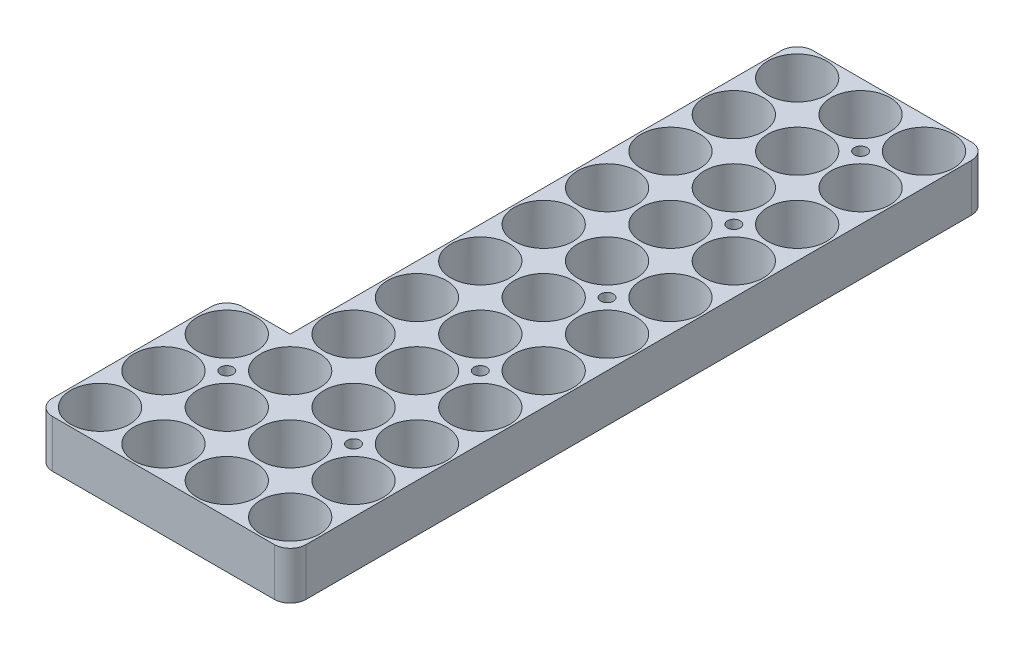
SolidWorks part; units mm, degrees
ref_plane "Plan de face" through (0, 0, 0) normal (0, 0, 1) x (1, 0, 0)
ref_plane "Plan de dessus" through (0, 0, 0) normal (0, 1, 0) x (1, 0, 0)
ref_plane "Plan de droite" through (0, 0, 0) normal (1, 0, 0) x (0, 0, -1)
sketch "Esquisse1" plane through (0, 0, 0) normal (0, 1, 0) x (1, 0, 0)
  line L0 (-50, 0) -> (50, 0) construction
  line L1 (50, 0) -> (50, 60) construction
  line L2 (50, 60) -> (30, 60) construction
  line L3 (30, 60) -> (30, 220)
  line L4 (30, 220) -> (-30, 220)
  line L5 (-30, 220) -> (-30, 60)
  line L6 (-30, 60) -> (-50, 60)
  line L7 (-50, 60) -> (-50, 0)
  line L8 (30, 60) -> (30, 0)
  line L9 (30, 0) -> (-50, 0)
  dimension "D1" = 20
  dimension "D2" = 60
  dimension "D3" = 220
  dimension "D4" = 60
extrude "Boss.-Extru.1" add sketch "Esquisse1" along normal blind 15
sketch "Esquisse2" plane through (0, 15, 0) normal (0, 1, 0) x (1, 0, 0)
  line L0 (-50, 60) -> (-50, 0) construction
  line L2 (-50, 0) -> (30, 0) construction
  circle A0 centre (-40, 10) radius 9.3
  dimension "D3" = 18.6
  dimension "D1" = 10
  dimension "D2" = 10
extrude "Enlèv. mat.-Extru.1" cut sketch "Esquisse2" against normal offset from surface (13.5 mm away) 1.5
pattern_linear "Répétition linéaire1" count 11 spacing 20 along (0, 0, -1) count 6 spacing 20 along (1, 0, 0) of "Enlèv. mat.-Extru.1"
sketch "Esquisse3" plane through (0, 15, 0) normal (0, 1, 0) x (1, 0, 0)
  line L2 (-40, 50) -> (-20, 30) construction
  circle A0 centre (-30, 40) radius 2
  circle A1 centre (-40, 50) radius 9.3 construction
  circle A3 centre (-20, 30) radius 9.3 construction
  dimension "D1" = 4
extrude "Enlèv. mat.-Extru.2" cut sketch "Esquisse3" against normal through all
pattern_linear "Répétition linéaire2" count 2 spacing 40 along (1, 0, 0) of "Enlèv. mat.-Extru.2"
pattern_linear "Répétition linéaire3" count 5 spacing 40 along (0, 0, -1) of "Répétition linéaire2"
sketch "Esquisse6" plane through (0, 0, 0) normal (0, -1, 0) x (1, 0, 0)
  line L0 (-29, -5) -> (-29, -15)
  line L1 (-29, -5) -> (29, -5)
  line L2 (-29, -15) -> (29, -15)
  line L3 (29, -5) -> (29, -15)
  line L4 (30, 0) -> (30, -220) construction
  line L5 (0, 0) -> (0, -5) construction
  line L6 (-50, 0) -> (30, 0) construction
  point P9 (-29, -10)
  dimension "D1" = 10
  dimension "D2" = 1
  dimension "D3" = 10
extrude "Enlèv. mat.-Extru.5" cut sketch "Esquisse6" against normal up to surface (1.5 mm away) contours L1 L3 L2 L0
pattern_linear "Répétition linéaire6" count 11 spacing 20 along (0, 0, -1) of "Enlèv. mat.-Extru.5"
sketch "Esquisse7" plane through (0, 0, 0) normal (0, -1, 0) x (1, 0, 0)
  line L0 (-45, -1) -> (-45, -59)
  line L1 (-45, -1) -> (-35, -1)
  line L2 (-45, -59) -> (-35, -59)
  line L3 (-35, -1) -> (-35, -59)
  line L4 (-29, -15) -> (29, -15) construction
  line L5 (-29, -5) -> (-29, -15) construction
  line L6 (-50, -60) -> (-50, 0) construction
  line L7 (-30, -60) -> (-50, -60) construction
  point P8 (-40, -59)
  dimension "D1" = 10
  dimension "D2" = 1
extrude "Enlèv. mat.-Extru.6" cut sketch "Esquisse7" against normal up to surface (1.5 mm away)
sketch "Esquisse8" plane through (0, 0, 0) normal (0, -1, 0) x (1, 0, 0)
  line L0 (-27.8416, -195) -> (-25, -197.8416)
  line L1 (-25, -197.8416) -> (-25, -202.1584)
  line L2 (-25, -202.1584) -> (-27.8416, -205)
  line L3 (-27.8416, -205) -> (-12.1584, -205)
  line L4 (-12.1584, -205) -> (-15, -202.1584)
  line L5 (-15, -202.1584) -> (-15, -197.8416)
  line L6 (-15, -197.8416) -> (-12.1584, -195)
  line L7 (-12.1584, -195) -> (-27.8416, -195)
  line L8 (-25, -200) -> (-15, -200) construction
  line L9 (-29, -185) -> (-29, -195) construction
  line L10 (-29, -195) -> (29, -195) construction
  line L11 (-29, -205) -> (29, -205) construction
  arc A4 (-27.8416, -205) -> (-29, -207.6569) centre (-20, -210) ccw construction
  arc A5 (-12.1584, -215) -> (-12.1584, -205) centre (-20, -210) ccw construction
  arc A6 (-29, -192.3431) -> (-27.8416, -195) centre (-20, -190) ccw construction
  point P16 (-23.0072, -195)
  point P17 (0, 0)
  point P18 (-16.2358, -205)
  point P19 (2.9345, -195)
  point P20 (-25.9828, -205)
  point P25 (0, 0)
  point P28 (-20, -205)
  point P33 (-21.2985, -205)
  point P34 (0, 0)
  point P35 (-20, -205)
extrude "Enlèv. mat.-Extru.7" cut sketch "Esquisse8" against normal up to surface (1.5 mm away)
pattern_linear "Répétition linéaire7" count 5 spacing 40 along (0, 0, 1) count 2 spacing 40 along (1, 0, 0) of "Enlèv. mat.-Extru.7"
sketch "Esquisse9" plane through (0, 0, 0) normal (0, -1, 0) x (1, 0, 0)
  line L0 (-29, -5) -> (-29, -15)
  line L1 (-29, -5) -> (-32.1584, -5)
  line L2 (-29, -15) -> (-32.1584, -15)
  line L4 (-35, -22.1584) -> (-35, -17.8416) construction
  line L5 (-35, -59) -> (-35, -1) construction
  line L6 (-35, -2.1584) -> (-35, -17.8416)
  arc A0 (-35, -2.1584) -> (-32.1584, -5) centre (-40, -10) cw
  arc A1 (-35, -2.1584) -> (-37.6569, -1) centre (-40, -10) ccw construction
  arc A2 (-32.1584, -15) -> (-35, -17.8416) centre (-40, -10) cw
extrude "Enlèv. mat.-Extru.8" cut sketch "Esquisse9" against normal up to surface (1.5 mm away)
fillet "Congé1" radius 5 5 edges at (30, 7.5, -220) (-30, 7.5, -220) (-50, 7.5, -60) (-50, 7.5, 0) (30, 7.5, 0)
